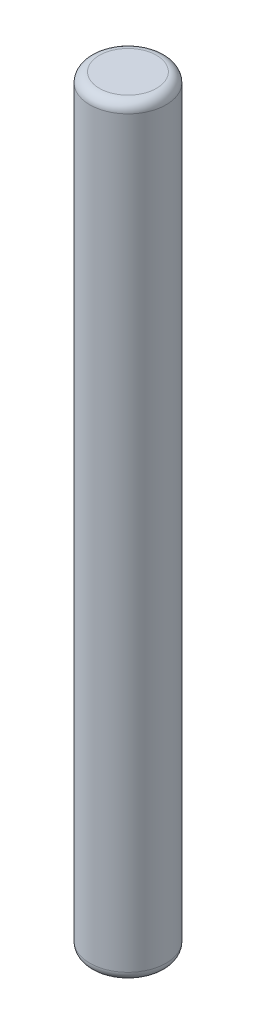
SolidWorks part; units mm, degrees
ref_plane "Спереди" through (0, 0, 0) normal (0, 0, 1) x (1, 0, 0)
ref_plane "Сверху" through (0, 0, 0) normal (0, 1, 0) x (1, 0, 0)
ref_plane "Справа" through (0, 0, 0) normal (1, 0, 0) x (0, 0, -1)
sketch "Эскиз1" plane through (0, 0, 0) normal (0, 1, 0) x (1, 0, 0)
  circle A0 centre (0, 0) radius 1
  dimension "D1" = 2
extrude "Бобышка-Вытянуть1" add sketch "Эскиз1" along normal mid plane 20
fillet "Скругление1" radius 0.25 2 edges at (0, -10, 1) (0, 10, 1)
